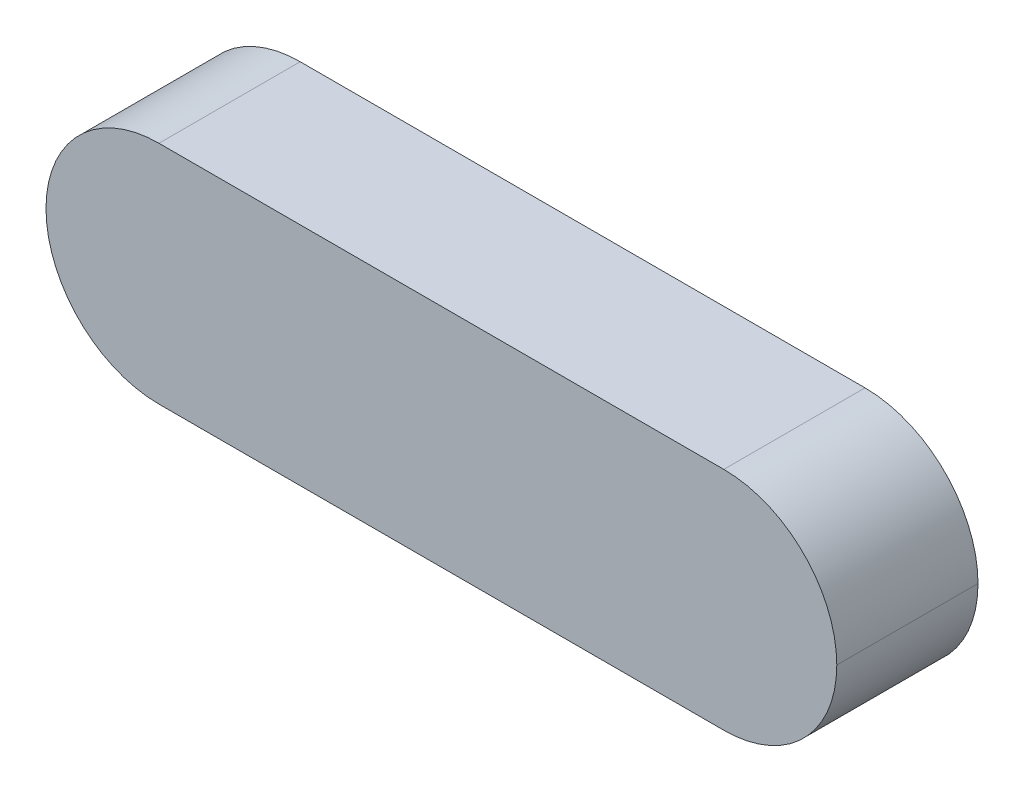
SolidWorks part; units mm, degrees
ref_plane "Спереди" through (0, 0, 0) normal (0, 0, 1) x (1, 0, 0)
ref_plane "Сверху" through (0, 0, 0) normal (0, 1, 0) x (1, 0, 0)
ref_plane "Справа" through (0, 0, 0) normal (1, 0, 0) x (0, 0, -1)
sketch "Эскиз1" plane through (0, 0, 0) normal (0, 0, 1) x (1, 0, 0)
  line L1 (28, -8) -> (-28, -8)
  line L2 (28, -8) -> (28, 8)
  line L3 (28, 8) -> (-28, 8)
  line L4 (-28, -8) -> (-28, 8)
  line L5 (28, -8) -> (-28, 8) construction
  line L6 (28, 8) -> (-28, -8) construction
  point P0 (0, 0)
  dimension "D1" = 16
  dimension "D2" = 56
extrude "Бобышка-Вытянуть1" add sketch "Эскиз1" along normal blind 10 contours L3 L4 L1 L2
fillet "Скругление1" radius 8 4 edges at (-28, -8, 5) (-28, 8, 5) (28, -8, 5) (28, 8, 5)
